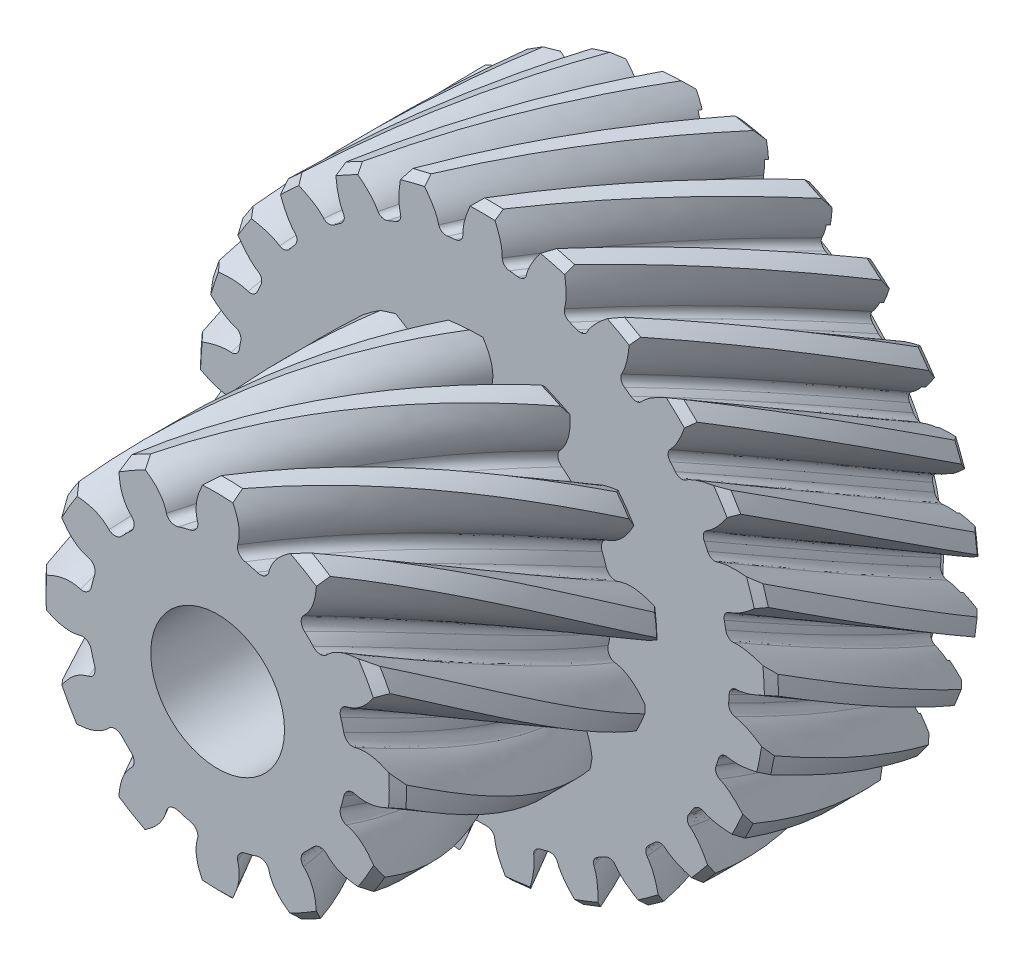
SolidWorks part; units mm, degrees
ref_plane "Plan de face" through (0, 0, 0) normal (0, 0, 1) x (1, 0, 0)
ref_plane "Plan de dessus" through (0, 0, 0) normal (0, 1, 0) x (1, 0, 0)
ref_plane "Plan de droite" through (0, 0, 0) normal (1, 0, 0) x (0, 0, -1)
other "Roues dentées hélicoïdales"
other "Roue dentée hélicoïdale 25 dents module 0,7<1>@Roues dentées hélicoïdales"
other "Roue dentée hélicoïdale 12 dents module 0.85<1>@Roues dentées hélicoïdales"
sketch "Esquisse2" plane through (0, 0, 0) normal (0, 0, 1) x (1, 0, 0)
  circle A0 centre (0, 0) radius 2.5
  dimension "D1" = 5
extrude "Enlèv. mat.-Extru.1" cut sketch "Esquisse2" against normal through all
